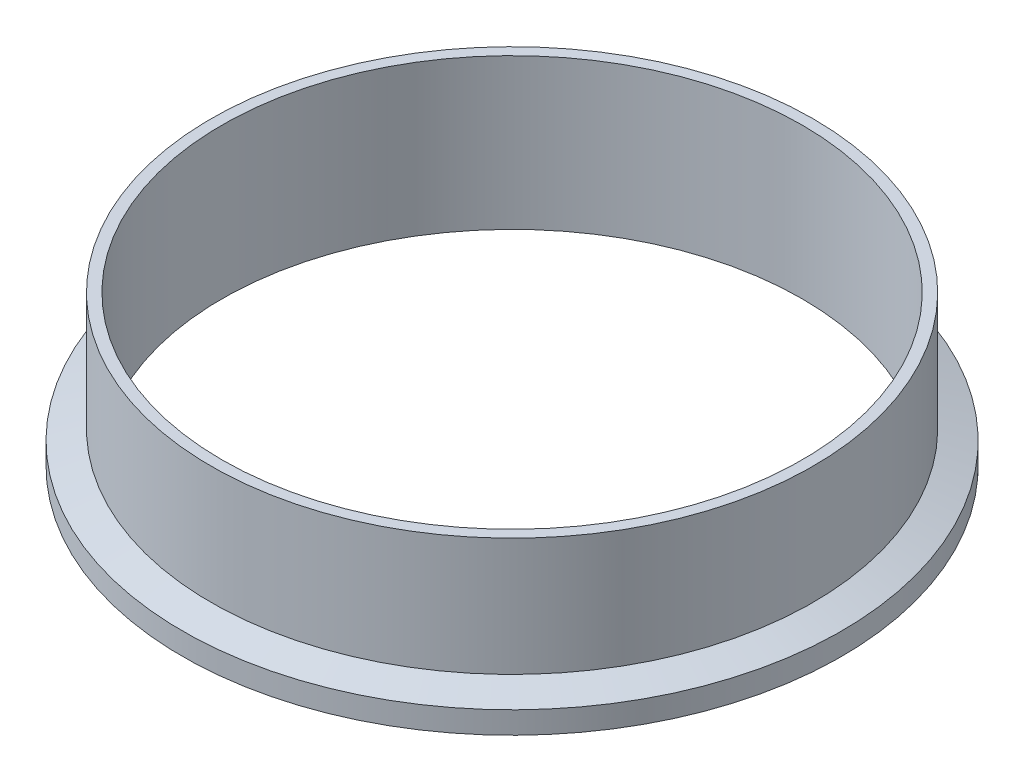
SolidWorks part; units mm, degrees
ref_plane "Front Plane" through (0, 0, 0) normal (0, 0, 1) x (1, 0, 0)
ref_plane "Top Plane" through (0, 0, 0) normal (0, 1, 0) x (1, 0, 0)
ref_plane "Right Plane" through (0, 0, 0) normal (1, 0, 0) x (0, 0, -1)
sketch "Sketch1" plane through (0, 0, 0) normal (0, 0, 1) x (1, 0, 0)
  line L0 (0, 0) -> (0, 38.1) construction
  line L1 (0, 38.1) -> (-76.2, 38.1)
  line L2 (-76.2, 38.1) -> (-76.2, 8.2228)
  line L3 (-76.2, 8.2228) -> (-83.439, 5.588)
  line L4 (-83.439, 5.588) -> (-83.439, 0)
  line L5 (-83.439, 0) -> (-79.9992, 0)
  line L6 (-76.3632, 0) -> (0, 0)
  line L7 (0, 0) -> (0, 38.1)
  line L8 (0, 38.1) -> (-73.4314, 38.1)
  line L9 (-73.4314, 38.1) -> (-73.4314, 0)
  line L10 (-73.4314, 0) -> (0, 0)
  line L11 (0, 0) -> (-0.1846, 0.0129)
  arc A0 (-79.2767, 0.4745) -> (-77.0857, 0.4745) centre (-78.1812, 0) cw
  arc A1 (-76.3632, 0) -> (-77.0857, 0.4745) centre (-76.3632, 0.7874) cw
  arc A2 (-79.2767, 0.4745) -> (-79.9992, 0) centre (-79.9992, 0.7874) cw
  point P12 (-76.9874, 0)
  dimension "D6" = 1.1938
  dimension "D7" = 0.7874
  dimension "3.00" = 76.2
  dimension "D2" = 5.588
  dimension "D3" = 83.439
  dimension "D4" = 70
  dimension "D5" = 78.1812
  dimension "D8" = 2.7686
  dimension "D9" = 38.1
revolve "Revolve2" add sketch "Sketch1" angle 360 about L0
